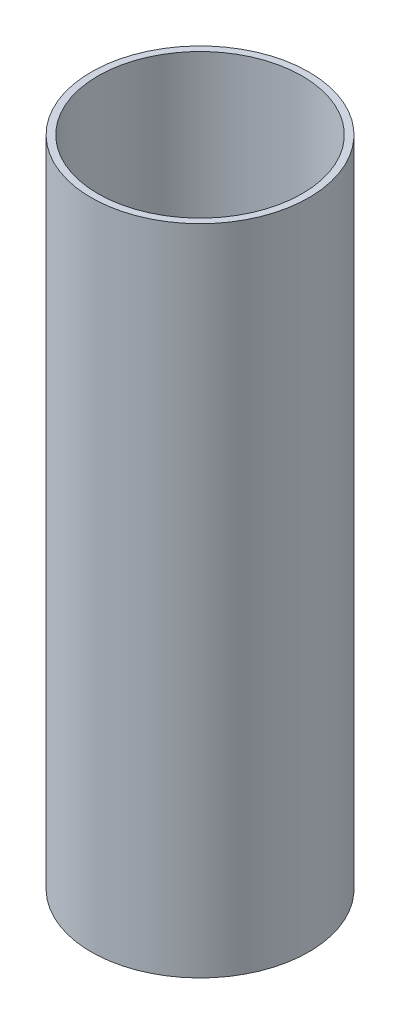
SolidWorks part; units mm, degrees
ref_plane "Front Plane" through (0, 0, 0) normal (0, 0, 1) x (1, 0, 0)
ref_plane "Top Plane" through (0, 0, 0) normal (0, 1, 0) x (1, 0, 0)
ref_plane "Right Plane" through (0, 0, 0) normal (1, 0, 0) x (0, 0, -1)
sketch "Sketch1" plane through (0, 0, 0) normal (0, 1, 0) x (1, 0, 0)
  circle A0 centre (0, 0) radius 25.4
  circle A1 centre (0, 0) radius 23.8125
  dimension "D1" = 50.8
  dimension "D2" = 1.5875
extrude "Boss-Extrude1" add sketch "Sketch1" along normal blind 152.4
